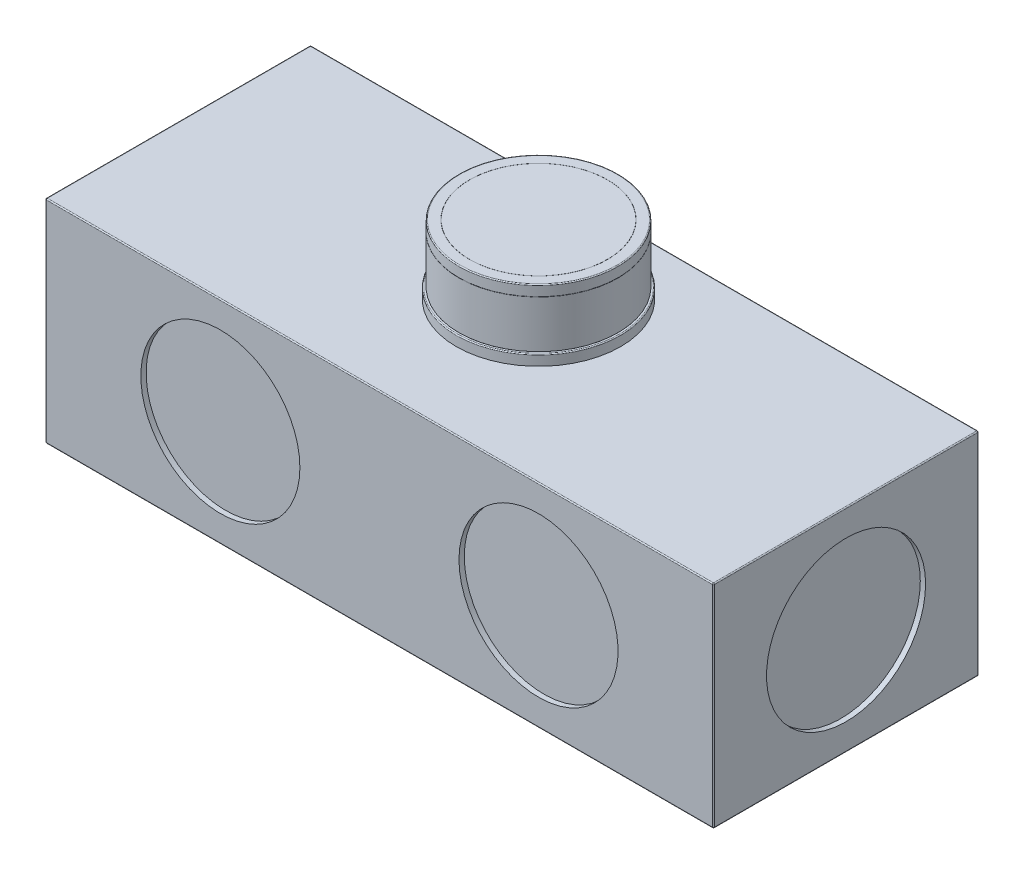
SolidWorks part; units mm, degrees
ref_plane "Front Plane" through (0, 0, 0) normal (0, 0, 1) x (1, 0, 0)
ref_plane "Top Plane" through (0, 0, 0) normal (0, 1, 0) x (1, 0, 0)
ref_plane "Right Plane" through (0, 0, 0) normal (1, 0, 0) x (0, 0, -1)
sketch "Sketch1" plane through (0, 0, 0) normal (0, 0, 1) x (1, 0, 0)
  line L1 (-31.5, 0) -> (31.5, 0)
  line L2 (-31.5, 0) -> (-31.5, 20)
  line L3 (-31.5, 20) -> (31.5, 20)
  line L4 (31.5, 0) -> (31.5, 20)
  dimension "D1" = 20
  dimension "D2" = 63
  dimension "D3" = 31.5
extrude "Boss-Extrude1" add sketch "Sketch1" along normal blind 25
sketch "Sketch2" plane through (31.5, 0, 0) normal (1, 0, 0) x (0, 0, -1)
  line L0 (-12.5, 20) -> (-12.5, 0) construction
  line L1 (-25, 20) -> (0, 20) construction
  line L2 (-25, 0) -> (0, 0) construction
  line L3 (0, 10) -> (-25, 10) construction
  line L4 (0, 0) -> (0, 20) construction
  line L5 (-25, 0) -> (-25, 20) construction
  circle A0 centre (-12.5, 10) radius 7.5
  dimension "D1" = 15
extrude "Cut-Extrude1" cut sketch "Sketch2" against normal blind 0.5
sketch "Sketch3" plane through (-31.5, 0, 0) normal (-1, 0, 0) x (0, 0, 1)
  line L0 (12.5, 20) -> (12.5, 0) construction
  line L1 (25, 20) -> (0, 20) construction
  line L2 (25, 0) -> (0, 0) construction
  line L3 (25, 10) -> (0, 10) construction
  line L4 (25, 20) -> (25, 0) construction
  line L5 (0, 20) -> (0, 0) construction
  circle A0 centre (12.5, 10) radius 7.5
  dimension "D1" = 15
extrude "Cut-Extrude2" cut sketch "Sketch3" against normal blind 0.5
sketch "Sketch4" plane through (0, 0, 0) normal (1, 0, 0) x (0, 0, -1)
  line L0 (-10, 26.5) -> (-10, -7.5) construction
  line L1 (-17.5, 21.019) -> (-17.5, 25.481)
  line L2 (-25, 0) -> (0, 0) construction
  line L3 (-17.41, 26.5) -> (-16.51, 26.5)
  line L4 (0, 0) -> (0, 20) construction
  line L5 (-17.75, -0.81) -> (-17.75, 20.91)
  line L6 (-17.66, -0.9) -> (-14.75, -0.9)
  line L7 (-25, 20) -> (0, 20) construction
  line L8 (-17.66, 21) -> (-17.4, 21)
  line L11 (-17.4, 21.01) -> (-17.491, 21.01)
  line L12 (-17.491, 25.49) -> (-17.49, 25.49)
  line L13 (-17.49, 25.49) -> (-17.49, 25.5)
  line L14 (-17.49, 25.5) -> (-17.491, 25.5)
  line L15 (-17.5, 25.509) -> (-17.5, 26.41)
  line L16 (-10, 26.5) -> (-10, -0.9)
  line L17 (-14.75, -0.9) -> (-14.75, -1)
  line L18 (-14.75, -1) -> (-10, -1)
  line L19 (-10, -0.9) -> (-10, -1)
  line L20 (-16.51, 26.5) -> (-16.51, 26.4)
  line L21 (-16.51, 26.4) -> (-16.5, 26.4)
  line L22 (-16.5, 26.4) -> (-16.5, 26.5)
  line L23 (-16.5, 26.5) -> (-10, 26.5)
  line L24 (-17.4, 21) -> (-17.4, 21.01)
  arc A0 (-17.75, 20.91) -> (-17.66, 21) centre (-17.66, 20.91) cw
  arc A1 (-17.75, -0.81) -> (-17.66, -0.9) centre (-17.66, -0.81) ccw
  arc A2 (-17.5, 26.41) -> (-17.41, 26.5) centre (-17.41, 26.41) cw
  arc A3 (-17.491, 25.49) -> (-17.5, 25.481) centre (-17.491, 25.481) ccw
  arc A4 (-17.491, 25.5) -> (-17.5, 25.509) centre (-17.491, 25.509) cw
  arc A5 (-17.491, 21.01) -> (-17.5, 21.019) centre (-17.491, 21.019) cw
  point P22 (-17.75, 21)
  point P25 (-17.75, -0.9)
  point P28 (-17.5, 26.5)
  point P34 (-17.5, 25.49)
  point P37 (-17.5, 25.5)
  dimension "D13" = 0.09
  dimension "D17" = 0.009
  dimension "D21" = 0.009
  dimension "D1" = 10
  dimension "D2" = 34
  dimension "D3" = 7.5
  dimension "D4" = 7.75
  dimension "D5" = 1
  dimension "D6" = 0.9
  dimension "D7" = 7.5
  dimension "D8" = 0.01
  dimension "D9" = 0.01
  dimension "D10" = 0.01
  dimension "D11" = 0.1
  dimension "D12" = 1
  dimension "D14" = 3
  dimension "D15" = 0.1
  dimension "D16" = 7.75
  dimension "D18" = 0.01
  dimension "D19" = 0.1
  dimension "D20" = 1
revolve "Revolve2" add sketch "Sketch4" angle 360 about L0
sketch "Sketch6" plane through (0, -1, 0) normal (0, -1, 0) x (1, 0, 0)
  line L1 (0, 17.7942) -> (-6.75, 13.8971)
  line L2 (-6.75, 13.8971) -> (-6.75, 6.1029)
  line L3 (-6.75, 6.1029) -> (0, 2.2058)
  line L4 (0, 2.2058) -> (6.75, 6.1029)
  line L5 (6.75, 6.1029) -> (6.75, 13.8971)
  line L6 (6.75, 13.8971) -> (0, 17.7942)
  circle A0 centre (0, 10) radius 6.75 construction
  dimension "D1" = 13.5
extrude "Boss-Extrude3" add sketch "Sketch6" along normal blind 6.5
sketch "Sketch7" plane through (0, 0, 0) normal (1, 0, 0) x (0, 0, -1)
  line L0 (-18.0242, -6.72) -> (-16.6384, -7.62)
  line L1 (-13.8971, -7.5) -> (-17.7942, -7.5) construction
  line L2 (-18.0242, -6.72) -> (-18.0242, -7.62)
  line L3 (-18.0242, -7.62) -> (-16.6384, -7.62)
  line L4 (-10, -1) -> (-10, -7.5) construction
  line L5 (-6.1029, -1) -> (-13.8971, -1) construction
  line L6 (-6.1029, -7.5) -> (-13.8971, -7.5) construction
  line L7 (-17.7942, -4.25) -> (-2.2058, -4.25) construction
  line L8 (-17.7942, -7.5) -> (-17.7942, -1) construction
  line L9 (-2.2058, -7.5) -> (-2.2058, -1) construction
  line L10 (-13.8971, -1) -> (-17.7942, -1) construction
  line L11 (-18.0242, -1.78) -> (-18.0242, -0.9241)
  line L12 (-18.0242, -1.78) -> (-16.7078, -0.9241)
  line L13 (-18.0242, -0.9241) -> (-16.7078, -0.9241)
  dimension "D1" = 33
  dimension "D2" = 0.9
  dimension "D3" = 3.25
  dimension "D4" = 0.12
  dimension "D5" = 0.0759
  dimension "D6" = 0.23
revolve "Cut-Revolve1" cut sketch "Sketch7" angle 360 about L4
fillet "Fillet2" radius 0.1 12 edges at (0, 20, 25) (31.5, 10, 25) (0, 0, 25) (-31.5, 10, 25) (0, 0, 0) (31.5, 10, 0) (0, 20, 0) (-31.5, 10, 0) (-31.5, 0, 12.5) (-31.5, 20, 12.5) (31.5, 0, 12.5) (31.5, 20, 12.5)
sketch "Sketch8" plane through (0, 0, 25) normal (0, 0, 1) x (1, 0, 0)
  line L0 (-31.4, 10) -> (31.4, 10) construction
  line L1 (-31.4, 19.9) -> (-31.4, 0.1) construction
  line L2 (31.4, 0.1) -> (31.4, 19.9) construction
  line L3 (0, 0) -> (0, 19.9) construction
  line L4 (31.4, 19.9) -> (-31.4, 19.9) construction
  circle A0 centre (-15, 10) radius 7.5
  circle A1 centre (15, 10) radius 7.5
  dimension "D1" = 15
  dimension "D2" = 15
extrude "Cut-Extrude3" cut sketch "Sketch8" against normal blind 0.5
